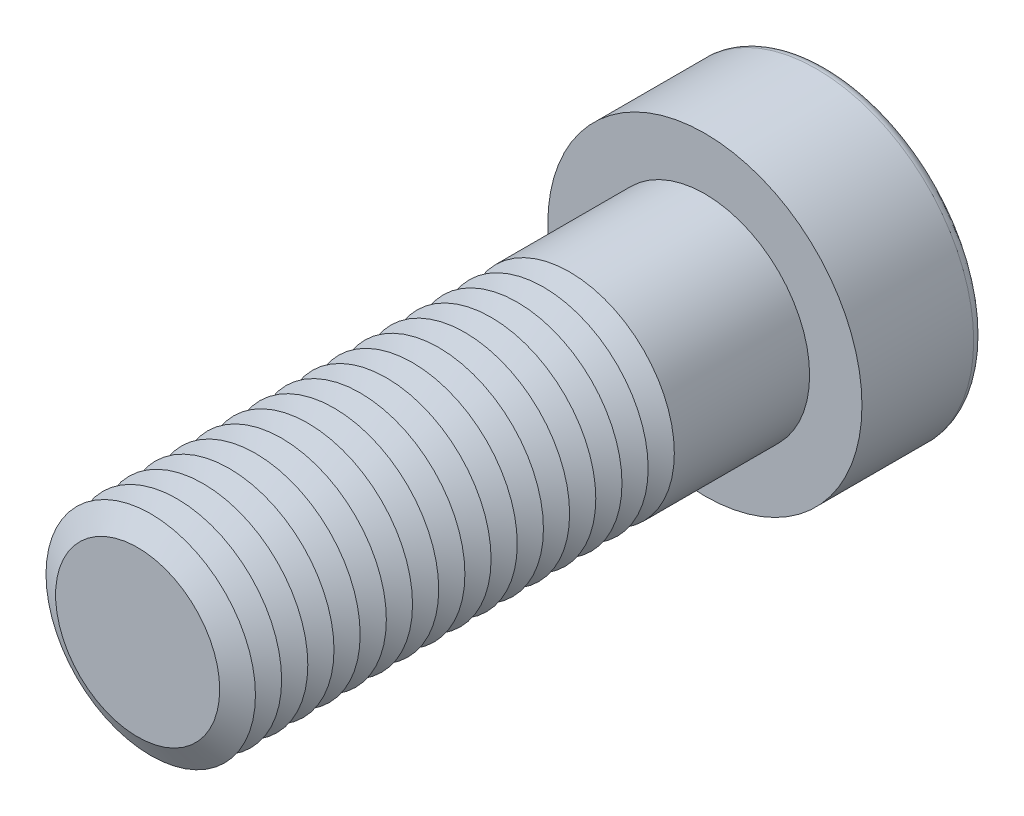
SolidWorks part; units mm, degrees
ref_plane "Front Plane" through (0, 0, 0) normal (0, 0, 1) x (1, 0, 0)
ref_plane "Top Plane" through (0, 0, 0) normal (0, 1, 0) x (1, 0, 0)
ref_plane "Right Plane" through (0, 0, 0) normal (1, 0, 0) x (0, 0, -1)
sketch "Sketch1" plane through (0, 0, 0) normal (0, 0, 1) x (1, 0, 0)
  circle A0 centre (0, 0) radius 12
  dimension "D1" = 24
extrude "Boss-Extrude1" add sketch "Sketch1" along normal blind 65
sketch "Sketch2" plane through (0, 0, 0) normal (0, 0, -1) x (-1, 0, 0)
  circle A0 centre (0, 0) radius 18
  dimension "D1" = 36
extrude "Boss-Extrude2" add sketch "Sketch2" along normal blind 14
sketch "Sketch3" plane through (0, 0, -14) normal (0, 0, -1) x (-1, 0, 0)
  line L1 (-5.4848, 9.5) -> (-10.9697, 0)
  line L2 (-10.9697, 0) -> (-5.4848, -9.5)
  line L3 (-5.4848, -9.5) -> (5.4848, -9.5)
  line L4 (5.4848, -9.5) -> (10.9697, 0)
  line L5 (10.9697, 0) -> (5.4848, 9.5)
  line L6 (5.4848, 9.5) -> (-5.4848, 9.5)
  circle A0 centre (0, 0) radius 9.5 construction
  dimension "D1" = 19
extrude "Cut-Extrude1" cut sketch "Sketch3" against normal blind 14.25
fillet "Fillet1" radius 1.2 1 edges at (-18, 0, -14)
sketch "Sketch4" plane through (0, 0, 0.25) normal (0, 0, -1) x (-1, 0, 0)
  line L0 (5.4848, -9.5) -> (10.9697, 0) construction
  circle A0 centre (0, 0) radius 9.5
extrude "Cut-Extrude2" cut sketch "Sketch4" against normal through all draft 60
sketch "Sketch5" plane through (0, 0, -14) normal (0, 0, -1) x (-1, 0, 0)
  circle A0 centre (0, 0) radius 10.9697
extrude "Cut-Extrude3" cut sketch "Sketch5" against normal through all draft 75
sketch "Sketch7" plane through (0, 0, 0) normal (1, 0, 0) x (0, 0, -1)
  line L25 (-65, 9.4019) -> (-63.5, 12)
  line L26 (-65, 12) -> (-65, -12) construction
  line L27 (-63.5, 12) -> (-66.5, 12)
  line L28 (-66.5, 12) -> (-65, 9.4019)
  line L29 (0, 12) -> (-65, 12) construction
  dimension "D1" = 3
revolve "Cut-Revolve1" cut sketch "Sketch7" angle 360 about axis through (0, 0, 65) along (0, 0, -1)
pattern_linear "LPattern1" count 17 spacing 3 along (0, 0, -1) of "Cut-Revolve1"
